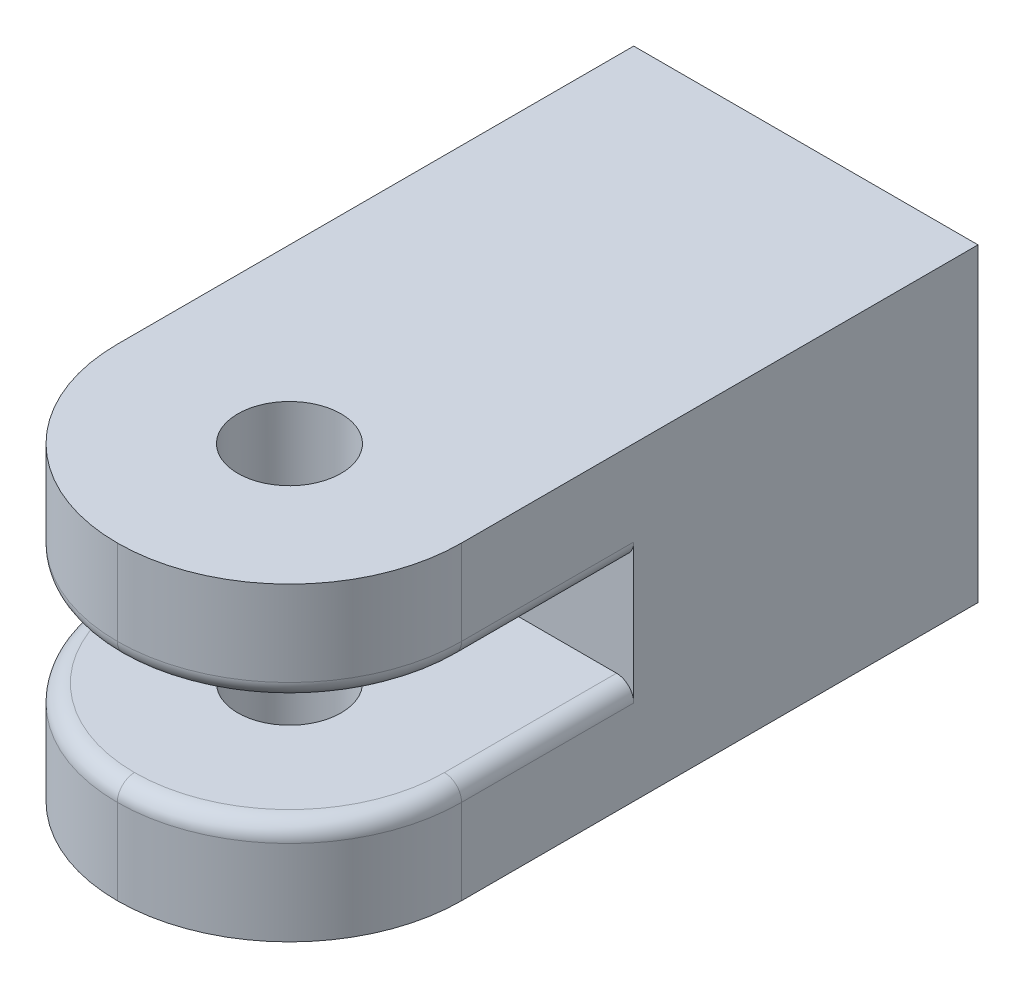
SolidWorks part; units mm, degrees
ref_plane "Ebene vorne" through (0, 0, 0) normal (0, 0, 1) x (1, 0, 0)
ref_plane "Ebene oben" through (0, 0, 0) normal (0, 1, 0) x (1, 0, 0)
ref_plane "Ebene rechts" through (0, 0, 0) normal (1, 0, 0) x (0, 0, -1)
sketch "Skizze1" plane through (0, 0, 0) normal (0, 0, 1) x (1, 0, 0)
  line L1 (0, 0) -> (10, 0)
  line L2 (0, 0) -> (0, 9)
  line L3 (0, 9) -> (10, 9)
  line L4 (10, 0) -> (10, 9)
  dimension "D1" = 9
  dimension "D2" = 10
extrude "Aufsatz-Linear austragen1" add sketch "Skizze1" along normal blind 20
sketch "Skizze2" plane through (0, 0, 20) normal (0, 0, 1) x (1, 0, 0)
  line L0 (0, 4.5) -> (10, 4.5) construction
  line L1 (0, 9) -> (0, 0) construction
  line L2 (10, 0) -> (10, 9) construction
  line L3 (5, 9) -> (5, 0) construction
  line L4 (10, 9) -> (0, 9) construction
  line L5 (0, 0) -> (10, 0) construction
  line L7 (0, 2.975) -> (10, 2.975)
  line L8 (0, 2.975) -> (0, 6.025)
  line L9 (0, 6.025) -> (10, 6.025)
  line L10 (10, 2.975) -> (10, 6.025)
  line L11 (0, 2.975) -> (10, 6.025) construction
  line L12 (0, 6.025) -> (10, 2.975) construction
  point P12 (5, 4.5)
  dimension "D1" = 3.05
extrude "Schnitt-Linear austragen1" cut sketch "Skizze2" against normal blind 10
sketch "Skizze3" plane through (0, 0, 0) normal (0, -1, 0) x (1, 0, 0)
  line L0 (5, 20) -> (5, 0) construction
  line L1 (0, 20) -> (10, 20) construction
  line L2 (0, 0) -> (10, 0) construction
  circle A0 centre (5, 15) radius 1.5
  dimension "D1" = 3
  dimension "D2" = 5
extrude "Schnitt-Linear austragen2" cut sketch "Skizze3" against normal blind 10
fillet "Verrundung1" radius 5 4 edges at (10, 1.4875, 20) (10, 7.5125, 20) (0, 7.5125, 20) (0, 1.4875, 20)
fillet "Verrundung2" radius 0.5 8 edges at (0, 6.025, 12.5) (1.4645, 6.025, 18.5355) (8.5355, 6.025, 18.5355) (0, 2.975, 12.5) (1.4645, 2.975, 18.5355) (8.5355, 2.975, 18.5355) (10, 6.025, 12.5) (10, 2.975, 12.5)
